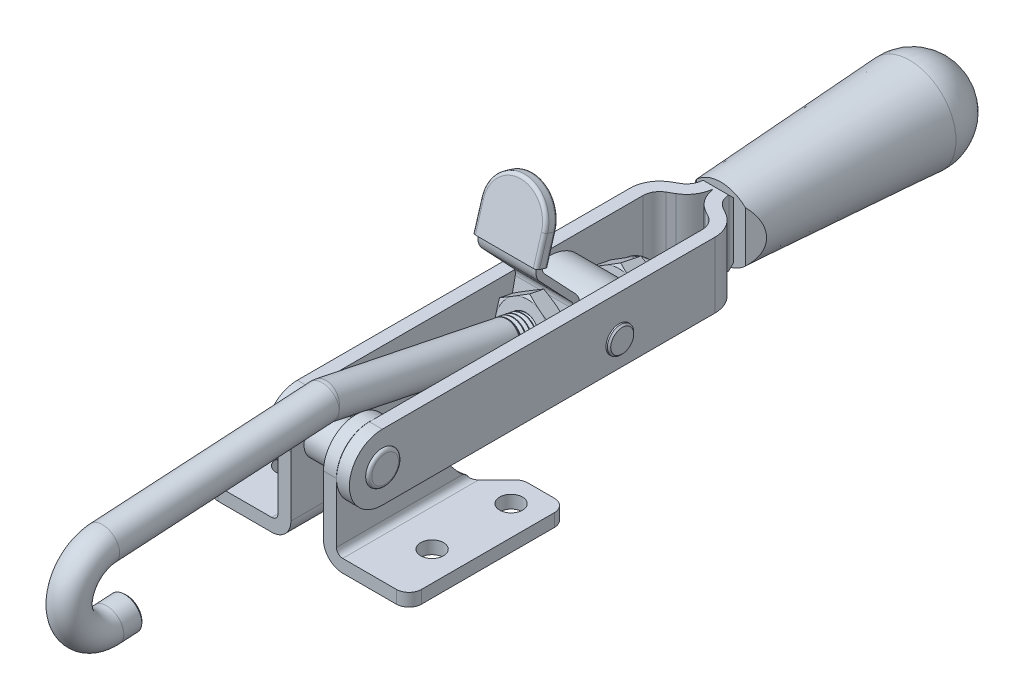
SolidWorks part; units mm, degrees
ref_plane "Front Plane" through (0, 0, 0) normal (0, 0, 1) x (1, 0, 0)
ref_plane "Top Plane" through (0, 0, 0) normal (0, 1, 0) x (1, 0, 0)
ref_plane "Right Plane" through (0, 0, 0) normal (1, 0, 0) x (0, 0, -1)
imported_body "5136A12 - Base-1-solid1"
imported_body "5136A12 - Lever-1-solid1"
imported_body "5136A12 - Handle-1-solid1"
imported_body "5136A12 - Spacer-1-solid1"
imported_body "5136A12 - Pivot-1-solid1"
imported_body "5136A12 - Hook-1-solid1"
imported_body "5136A12 - Lever 2-1-solid1"
imported_body "5136A12 - Handle 2-1-solid1"
imported_body "5136A12 - Nut-1-solid1"
imported_body "5136A12 - Lock Nut-1-solid1"
move or copy body "Body-Move/Copy1" bodies to move or copy 107 placed by mates yes
other "Distance1" parameters "D1"=6.35
